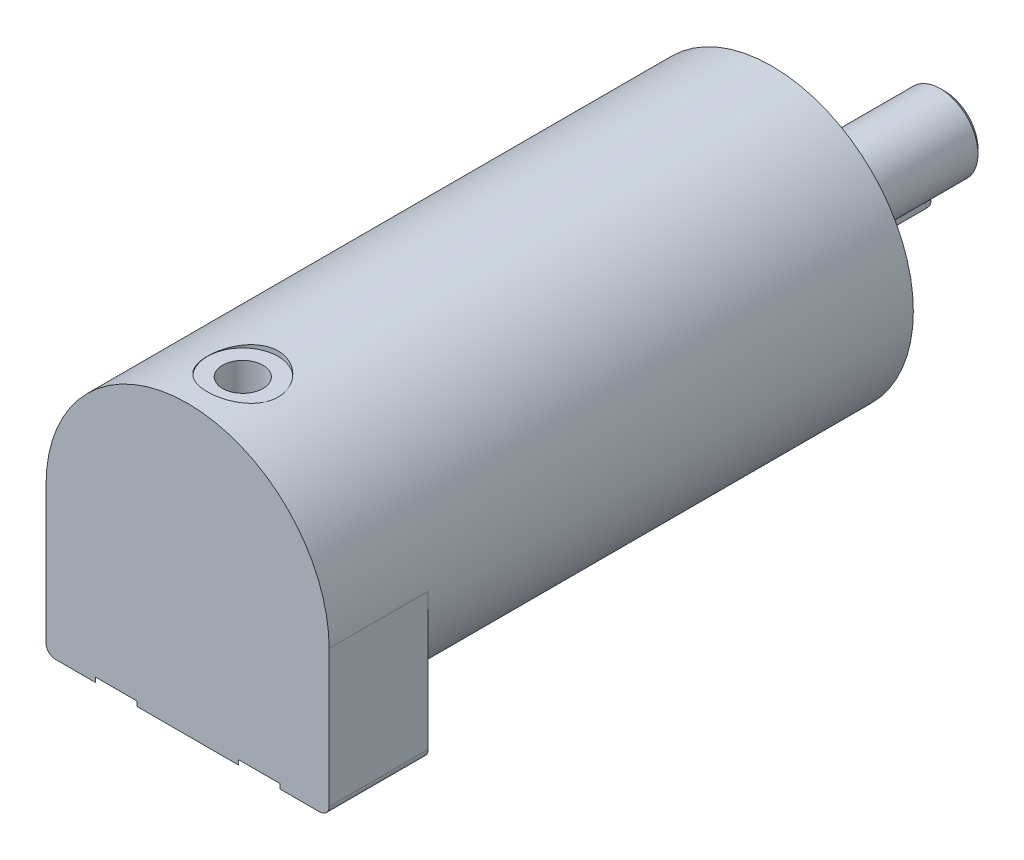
SolidWorks part; units mm, degrees
ref_plane "Face" through (0, 0, 0) normal (0, 0, 1) x (1, 0, 0)
ref_plane "Dessus" through (0, 0, 0) normal (0, 1, 0) x (1, 0, 0)
ref_plane "Droite" through (0, 0, 0) normal (1, 0, 0) x (0, 0, -1)
sketch "Esquisse1" plane through (0, 0, 0) normal (1, 0, 0) x (0, 0, -1)
  line L0 (0, 0) -> (36.7, 0) construction
  line L1 (0, 0) -> (0, 15.75)
  line L2 (0, 15.75) -> (5, 15.75)
  line L3 (5, 15.75) -> (5, 8.5)
  line L4 (5, 8.5) -> (7.7, 8.5)
  line L5 (7.7, 8.5) -> (7.7, 8)
  line L6 (7.7, 8) -> (36.7, 8)
  line L7 (36.7, 8) -> (36.7, 0)
  line L8 (0, 0) -> (36.7, 0)
  dimension "D1" = 29
  dimension "D2" = 5
  dimension "D3" = 36.7
  dimension "D4" = 31.5
  dimension "D5" = 16
  dimension "D6" = 17
revolve "Révolution1" add sketch "Esquisse1" angle 360 about L0
chamfer "Chanfrein1" distance 1 angle 45 1 edges at (8, 0, -36.7)
sketch "Esquisse2" plane through (0, 0, -36.7) normal (0, 0, -1) x (-1, 0, 0)
  line L0 (0, 0) -> (0, 8) construction
  circle A0 centre (0, 0) radius 8 construction
  point P0 (0, 0)
  point P1 (0, 8)
hole_wizard "Trou taraudé M6x1.01" positions "Esquisse3D1" profile "Esquisse3" tap size "M6x1.0" standard "ISO"
sketch3d "Esquisse3D1"
  point P0 (0, 0, 0)
  point P2 (0, 0, -36.7)
sketch "Esquisse3" plane through (0, 0, -36.7) normal (1, 0, 0) x (0, 1, 0)
  line L0 (0, 0) -> (0, 20.5022)
  line L1 (0, 20.5022) -> (2.5, 19)
  line L2 (2.5, 19) -> (2.5, 3.7321)
  line L3 (2.5, 3.7321) -> (3.5, 0)
  line L5 (3.5, 0) -> (0, 0)
  line L6 (-2.5, 3.7321) -> (-3.5, 0) construction
  line L10 (0, 20.5022) -> (-2.5, 19) construction
  line L11 (0, -6.35) -> (0, 107.95) construction
  dimension "Diamètre du trou pour taraudage" = 5
  dimension "Profondeur du trou pour taraudage" = 19
  dimension "Diamètre du fraisage entrant" = 7
  dimension "Angle du fraisage entrant" = 30
  dimension "Angle de pointe" = 118
ref_plane "Plan1" through (0, 8, 0) normal (0, 1, 0) x (-1, 0, 0)
ref_plane "Plan2" through (0, -10, 0) normal (0, 1, 0) x (-1, 0, 0)
sketch "Esquisse4" plane through (0, -10, 0) normal (0, 1, 0) x (-1, 0, 0)
  line L0 (-2.5, -18.7) -> (-2.5, -30.2)
  line L1 (2.5, -30.2) -> (2.5, -18.7)
  line L2 (0, -18.7) -> (0, -36.7) construction
  line L3 (-7, -36.7) -> (7, -36.7) construction
  arc A0 (-2.5, -30.2) -> (2.5, -30.2) centre (0, -30.2) ccw
  arc A1 (2.5, -18.7) -> (-2.5, -18.7) centre (0, -18.7) ccw
  dimension "D2" = 4
  dimension "D3" = 16.5
  dimension "D1" = 5
extrude "Extrusion1" add sketch "Esquisse4" along normal up to body separate body
sketch "Esquisse5" plane through (0, 0, 0) normal (0, 0, 1) x (1, 0, 0)
  circle A0 centre (0, 0) radius 30
  dimension "D1" = 60
extrude "Extrusion2" add sketch "Esquisse5" along normal blind 123.8
sketch "Esquisse6" plane through (0, 0, 123.8) normal (0, 0, 1) x (1, 0, 0)
  line L0 (-30, 0) -> (-30, -29)
  line L1 (-28, -31) -> (28, -31)
  line L2 (30, -29) -> (30, 0)
  line L3 (30, 0) -> (-30, 0) construction
  circle A0 centre (0, 0) radius 30 construction
  arc A1 (-30, -29) -> (-28, -31) centre (-28, -29) ccw
  arc A2 (28, -31) -> (30, -29) centre (28, -29) ccw
  arc A4 (-30, 0) -> (30, 0) centre (0, 0) ccw
  dimension "D1" = 61
  dimension "D2" = 2
extrude "Extrusion3" add sketch "Esquisse6" against normal blind 21
sketch "Esquisse7" plane through (0, -31, 0) normal (0, -1, 0) x (1, 0, 0)
  line L0 (0, 123.8) -> (0, 112.1) construction
  line L1 (-28, 123.8) -> (28, 123.8) construction
  line L2 (-15.15, 112.1) -> (15.15, 112.1) construction
  circle A0 centre (-15.15, 112.1) radius 12.5
  circle A1 centre (15.15, 112.1) radius 12.5
  point P6 (15.15, 112.1)
  point P7 (-15.15, 112.1)
  dimension "D3" = 25
  dimension "D1" = 30.3
  dimension "D2" = 11.7
extrude "Enlèv. mat.-Extru.1" cut sketch "Esquisse7" against normal blind 1
sketch "Esquisse8" plane through (0, -30, 0) normal (0, -1, 0) x (1, 0, 0)
  circle A0 centre (15.15, 112.1) radius 7.475
  circle A1 centre (-15.15, 112.1) radius 7.475
  arc A2 (-6.7978, 102.8) -> (-10.75, 123.8) centre (-15.15, 112.1) ccw construction
  arc A3 (23.5022, 102.8) -> (19.55, 123.8) centre (15.15, 112.1) ccw construction
  dimension "D1" = 14.95
extrude "Enlèv. mat.-Extru.2" cut sketch "Esquisse8" against normal blind 30
ref_plane "Plan3" through (0, 29, 0) normal (0, 1, 0) x (-1, 0, 0)
sketch "Esquisse9" plane through (0, 29, 0) normal (0, 1, 0) x (-1, 0, 0)
  line L0 (0, 123.8) -> (0, 112.1) construction
  line L1 (30, 123.8) -> (-30, 123.8) construction
  line L2 (0, 112.1) -> (15.15, 112.1) construction
  circle A0 centre (15.15, 112.1) radius 7.475 construction
  circle A1 centre (0, 112.1) radius 7.5
  dimension "D1" = 15
extrude "Enlèv. mat.-Extru.3" cut sketch "Esquisse9" along normal through all
sketch "Esquisse10" plane through (0, 29, 0) normal (0, 1, 0) x (-1, 0, 0)
  circle A0 centre (0, 112.1) radius 7.5 construction
  circle A1 centre (0, 112.1) radius 4.285
  point P0 (0, 112.1)
  dimension "D1" = 8.57
extrude "Enlèv. mat.-Extru.4" cut sketch "Esquisse10" against normal blind 30
sketch "Esquisse11" plane through (0, 0, 0) normal (0, 0, -1) x (-1, 0, 0)
  line L0 (0, 0) -> (0, -22.5) construction
  line L1 (0, 0) -> (15.9099, 15.9099) construction
  line L2 (15.9099, 15.9099) -> (-15.9099, 15.9099) construction
  line L3 (-15.9099, 15.9099) -> (0, 0) construction
  circle A0 centre (0, 0) radius 22.5 construction
  point P4 (0, -22.5)
  point P5 (-15.9099, 15.9099)
  point P6 (15.9099, 15.9099)
  dimension "D1" = 45
  dimension "D2" = 90
hole_wizard "Trou taraudé M6x1.02" positions "Esquisse3D2" profile "Esquisse12" tap size "M6x1.0" standard "ISO"
sketch3d "Esquisse3D2"
  point P0 (0, -22.5, 0)
  point P2 (-15.9099, 15.9099, 0)
  point P4 (15.9099, 15.9099, 0)
sketch "Esquisse12" plane through (0, -22.5, 0) normal (1, 0, 0) x (0, 1, 0)
  line L0 (0, 0) -> (0, 16.5022)
  line L1 (0, 16.5022) -> (2.5, 15)
  line L2 (2.5, 15) -> (2.5, 0)
  line L5 (2.5, 0) -> (0, 0)
  line L10 (0, 16.5022) -> (-2.5, 15) construction
  line L11 (0, -6.35) -> (0, 107.95) construction
  dimension "Diamètre du trou pour taraudage" = 5
  dimension "Profondeur du trou pour taraudage" = 15
  dimension "Angle de pointe" = 118
chamfer "Chanfrein2" distance 1 angle 45 1 edges at (15.75, 0, -5)
